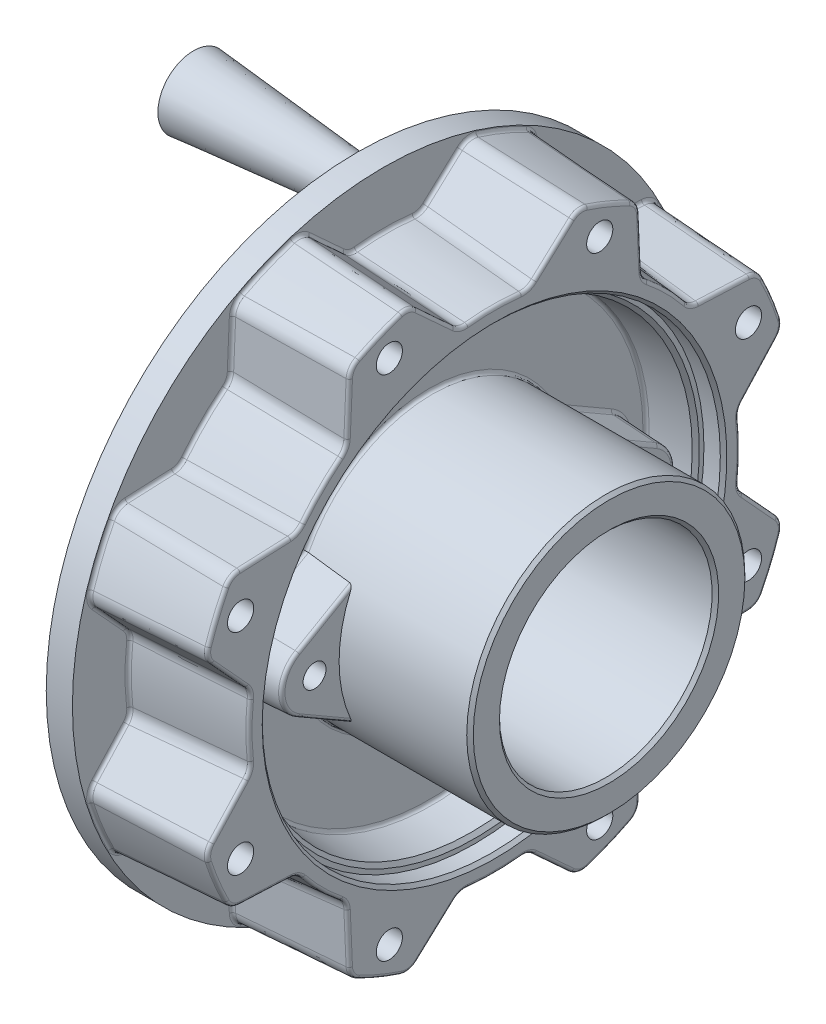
SolidWorks part; units mm, degrees
ref_plane "Front Plane" through (0, 0, 0) normal (0, 0, 1) x (1, 0, 0)
ref_plane "Top Plane" through (0, 0, 0) normal (0, 1, 0) x (1, 0, 0)
ref_plane "Right Plane" through (0, 0, 0) normal (1, 0, 0) x (0, 0, -1)
body saved out of another part "Stock-Pump Coupling-1"
sketch "Sketch1" plane through (8, 0, 0) normal (-1, 0, 0) x (0, 0, 1)
  line L0 (0, 0) -> (0, 86) construction
  line L1 (0, 0) -> (-95, 0) construction
  circle A0 centre (0, 86) radius 6.5
  circle A1 centre (0, 0) radius 95 construction
  circle A2 centre (0, -86) radius 6.5
  dimension "D1" = 13
  dimension "D2" = 86
extrude "Boss-Extrude1" add sketch "Sketch1" along normal blind 50 draft 5
